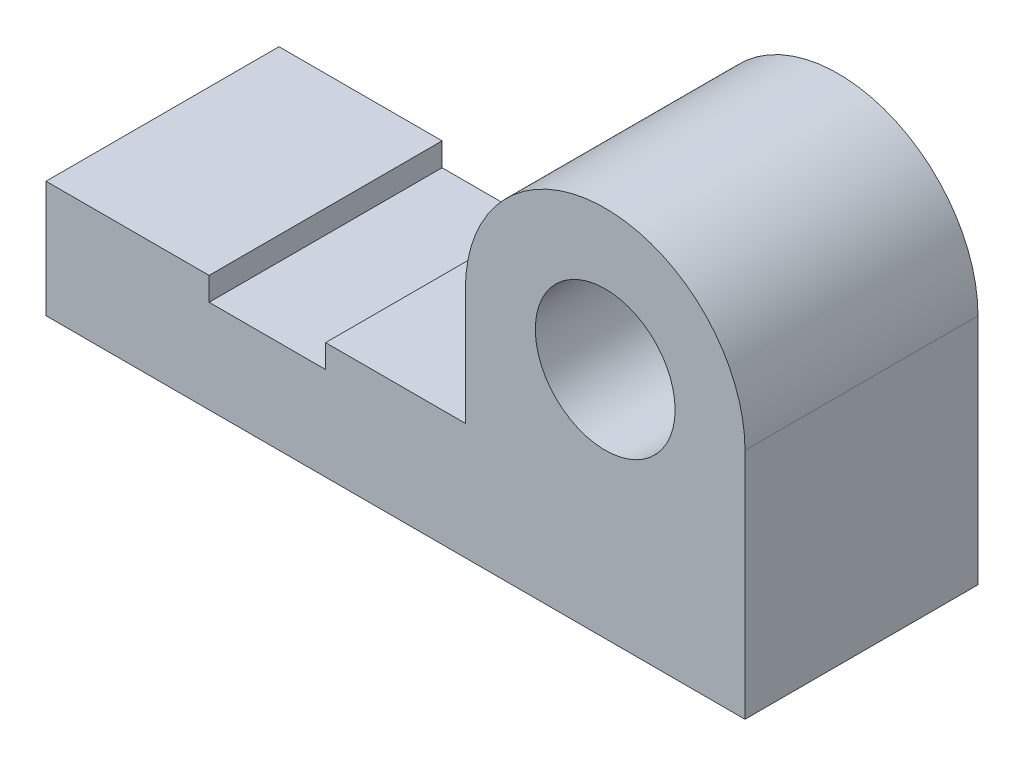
SolidWorks part; units mm, degrees
ref_plane "Front Plane" through (0, 0, 0) normal (0, 0, 1) x (1, 0, 0)
ref_plane "Top Plane" through (0, 0, 0) normal (0, 1, 0) x (1, 0, 0)
ref_plane "Right Plane" through (0, 0, 0) normal (1, 0, 0) x (0, 0, -1)
sketch "Sketch2" plane through (0, 0, 0) normal (0, 0, 1) x (1, 0, 0)
  line L0 (0, 0) -> (300, 0)
  line L1 (300, 0) -> (300, 100)
  line L2 (180, 100) -> (180, 50)
  line L3 (180, 50) -> (120, 50)
  line L4 (120, 50) -> (120, 40)
  line L5 (120, 40) -> (70, 40)
  line L6 (70, 40) -> (70, 50)
  line L7 (70, 50) -> (0, 50)
  line L8 (0, 50) -> (0, 0)
  line L9 (202.0826, 100) -> (277.1606, 100) construction
  line L10 (240, 143.381) -> (240, 78.0958) construction
  arc A0 (300, 100) -> (180, 100) centre (240, 100) ccw
  circle A1 centre (240, 100) radius 30
  dimension "D7" = 60
  dimension "D8" = 60
  dimension "D1" = 300
  dimension "D2" = 50
  dimension "D3" = 70
  dimension "D4" = 50
  dimension "D5" = 10
  dimension "D6" = 100
extrude "Boss-Extrude1" add sketch "Sketch2" along normal blind 100 contours L5 L6 L7 L8 L0 L1 A0 L2 L3 L4 | A1
equation "\"Length\"= \"D1@Sketch2\"'length of the model"
equation "\"D8@Sketch2\" = \"D1@Sketch2\" / 5'Radius"
equation "\"D7@Sketch2\" = \"D1@Sketch2\" / 5'Diameter"
equation "\"D2@Sketch2\" = \"D1@Sketch2\" / 6'Height"
equation "\"D6@Sketch2\" = \"D1@Sketch2\" / 3'Hole location"
equation "\"D3@Sketch2\" = \"D1@Sketch2\" / 30 * 7'Slot location"
equation "\"D4@Sketch2\" = \"D1@Sketch2\" / 6'Slot"
equation "\"D5@Sketch2\" = \"D1@Sketch2\" / 30'Slot depth"
equation "\"D1@Boss-Extrude1\" = \"D1@Sketch2\" / 3'Extrude"
